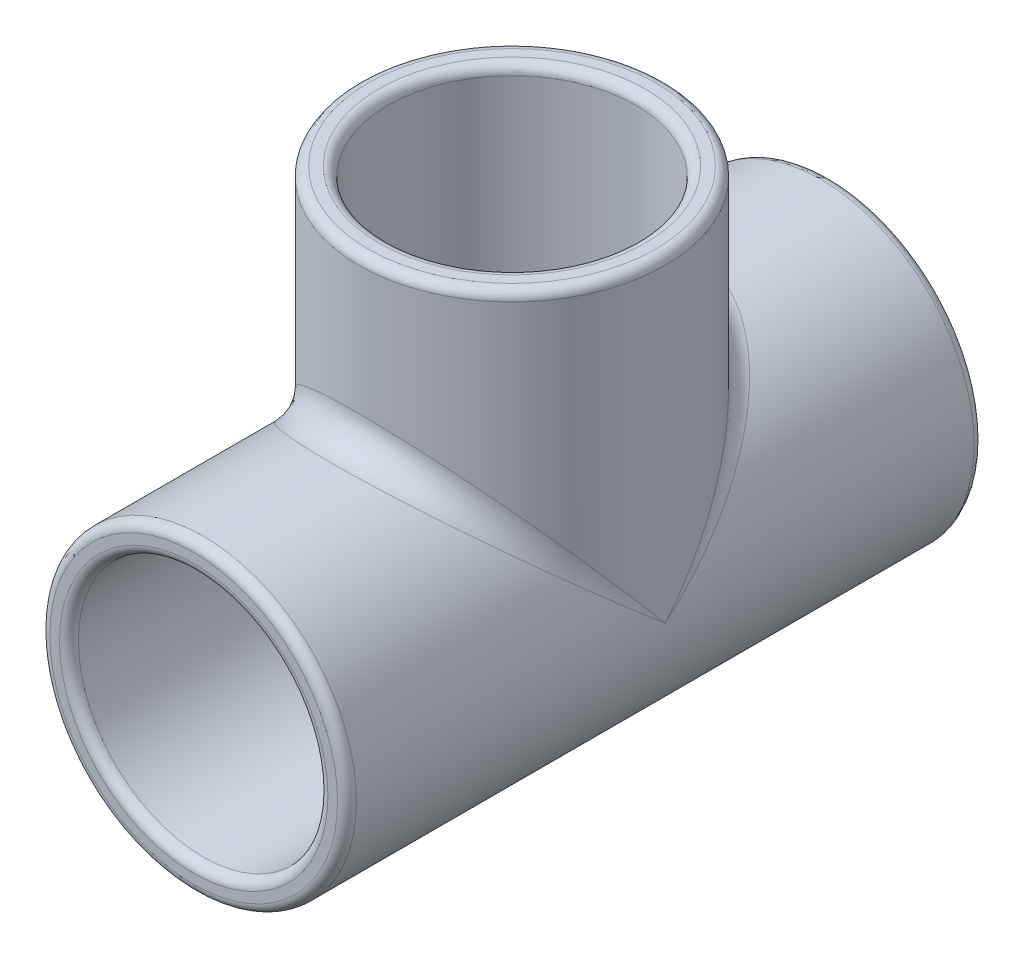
SolidWorks part; units mm, degrees
ref_plane "Front" through (0, 0, 0) normal (0, 0, 1) x (1, 0, 0)
ref_plane "Top" through (0, 0, 0) normal (0, 1, 0) x (1, 0, 0)
ref_plane "Right" through (0, 0, 0) normal (1, 0, 0) x (0, 0, -1)
sketch "Sketch1" plane through (0, 0, 0) normal (0, 0, 1) x (1, 0, 0)
  circle A0 centre (0, 0) radius 20.6375
  circle A1 centre (0, 0) radius 16.8021
  dimension "D1" = 41.275
  dimension "D2" = 33.6042
extrude "Extrude1" add sketch "Sketch1" along normal blind 85.725
sketch "Sketch2" plane through (0, 0, 0) normal (0, 1, 0) x (1, 0, 0)
  line L0 (20.6375, -85.725) -> (20.6375, 0) construction
  line L1 (20.6375, -85.725) -> (20.6375, 0) construction
  line L2 (-20.6375, 0) -> (-20.6375, -85.725) construction
  line L3 (-20.6375, 0) -> (-20.6375, -85.725) construction
  line L4 (20.6375, 0) -> (-20.6375, 0) construction
  circle A0 centre (0, -42.8625) radius 20.6375
  circle A1 centre (0, -42.8625) radius 16.7005
  dimension "D1" = 33.401
  dimension "D2" = 42.8625
extrude "Extrude2" add sketch "Sketch2" along normal blind 42.9895
sketch "Sketch4" plane through (0, 0, 85.725) normal (0, 0, 1) x (1, 0, 0)
  circle A0 centre (0, 0) radius 16.8021 construction
  circle A1 centre (0, 0) radius 16.8021
extrude "Cut-Extrude2" cut sketch "Sketch4" against normal blind 89.1794
sketch "Sketch5" plane through (0, 42.9895, 0) normal (0, 1, 0) x (-1, 0, 0)
  circle A0 centre (0, 42.8625) radius 16.7005 construction
  circle A1 centre (0, 42.8625) radius 16.7005
extrude "Cut-Extrude3" cut sketch "Sketch5" against normal blind 42.9895
sketch "Sketch8" plane through (0, 0, 0) normal (0, 0, 1) x (1, 0, 0)
  circle A0 centre (0, 0) radius 14.3479
  circle A1 centre (0, 0) radius 16.8853
extrude "Extrude3" add sketch "Sketch8" along normal blind 73.9394
sketch "Sketch9" plane through (0, 0, 0) normal (0, 0, -1) x (-1, 0, 0)
  circle A0 centre (0, 0) radius 16.8021
  dimension "D1" = 33.6042
extrude "Cut-Extrude4" cut sketch "Sketch9" against normal blind 25.4
sketch "Sketch10" plane through (0, 0, 85.725) normal (0, 0, 1) x (1, 0, 0)
  circle A1 centre (0, 0) radius 16.8021 construction
  circle A2 centre (0, 0) radius 16.8021
extrude "Cut-Extrude5" cut sketch "Sketch10" against normal blind 25.4
sketch "Sketch11" plane through (0, 42.9895, 0) normal (0, 1, 0) x (-1, 0, 0)
  circle A0 centre (0, 42.8625) radius 16.7005 construction
  circle A1 centre (0, 42.8625) radius 16.7005
extrude "Cut-Extrude6" cut sketch "Sketch11" against normal blind 42.9895
sketch "Sketch13" plane through (0, 0, 0) normal (0, 1, 0) x (1, 0, 0)
  circle A0 centre (0, -42.8625) radius 16.7005 construction
  circle A1 centre (0, -42.8625) radius 16.7005
  circle A2 centre (0, -42.8625) radius 13.82
extrude "Extrude4" add sketch "Sketch13" along normal blind 42.9895
sketch "Sketch15" plane through (0, 0, 0) normal (0, 0, -1) x (-1, 0, 0)
  circle A0 centre (0, 0) radius 14.3479 construction
  circle A1 centre (0, 0) radius 14.3479
extrude "Cut-Extrude8" cut sketch "Sketch15" against normal through all
sketch "Sketch16" plane through (0, 42.9895, 0) normal (0, 1, 0) x (1, 0, 0)
  circle A0 centre (0, -42.8625) radius 16.7005
extrude "Cut-Extrude9" cut sketch "Sketch16" against normal blind 25.4
fillet "Fillet1" radius 3.81 2 edges at (0, 20.6375, 63.5) (0, 20.6375, 22.225)
fillet "Fillet2" radius 1.27 6 edges at (-16.8021, 0, 0) (20.6375, 0, 0) (16.8021, 0, 85.725) (20.6375, 0, 85.725) (0, 42.9895, 63.5) (0, 42.9895, 59.563)
